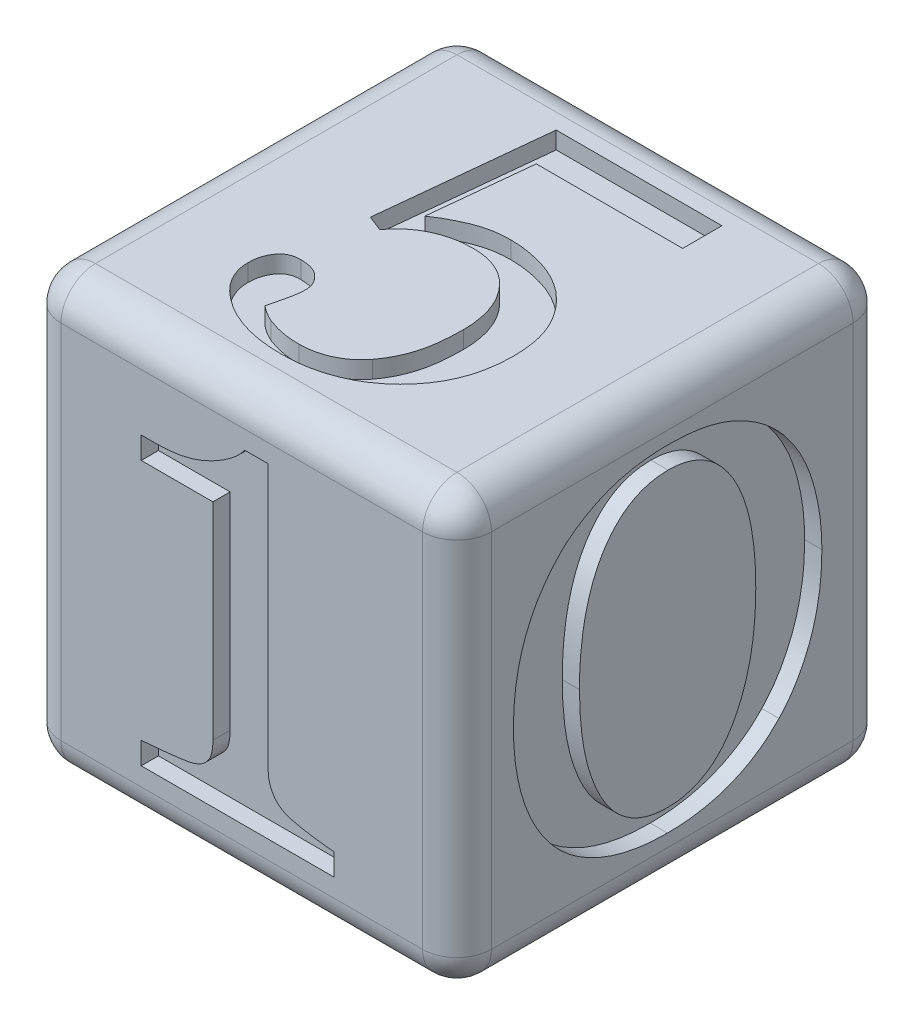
SolidWorks part; units mm, degrees
ref_plane "Front Plane" through (0, 0, 0) normal (0, 0, 1) x (1, 0, 0)
ref_plane "Top Plane" through (0, 0, 0) normal (0, 1, 0) x (1, 0, 0)
ref_plane "Right Plane" through (0, 0, 0) normal (1, 0, 0) x (0, 0, -1)
sketch "Sketch1" plane through (0, 0, 0) normal (0, 1, 0) x (1, 0, 0)
  line L1 (-12.5, 12.5) -> (12.5, 12.5)
  line L2 (-12.5, 12.5) -> (-12.5, -12.5)
  line L3 (-12.5, -12.5) -> (12.5, -12.5)
  line L4 (12.5, 12.5) -> (12.5, -12.5)
  line L5 (-12.5, 12.5) -> (12.5, -12.5) construction
  line L6 (-12.5, -12.5) -> (12.5, 12.5) construction
  point P0 (0, 0)
  dimension "D1" = 25
  dimension "D2" = 25
extrude "Boss-Extrude1" add sketch "Sketch1" along normal blind 25
fillet "Fillet1" radius 2 4 edges at (12.5, 12.5, 12.5) (12.5, 25, 0) (12.5, 12.5, -12.5) (12.5, 0, 0)
fillet "Fillet2" radius 2 5 edges at (11.9142, 24.4142, 11.9142) (11.9142, 0.5858, 11.9142) (-1, 25, 12.5) (-12.5, 12.5, 12.5) (-1, 0, 12.5)
fillet "Fillet3" radius 2 5 edges at (-11.9142, 24.4142, 11.9142) (-11.9142, 0.5858, 11.9142) (-12.5, 25, -1) (-12.5, 12.5, -12.5) (-12.5, 0, -1)
fillet "Fillet4" radius 2 6 edges at (11.9142, 24.4142, -11.9142) (-11.9142, 24.4142, -11.9142) (11.9142, 0.5858, -11.9142) (-11.9142, 0.5858, -11.9142) (0, 25, -12.5) (0, 0, -12.5)
sketch "Sketch9" plane through (0, 0, 0) normal (0, -1, 0) x (1, 0, 0)
  text T0 "3" font "Georgia" height 19
extrude "Cut-Extrude7" cut sketch "Sketch9" against normal blind 1
sketch "Sketch10" plane through (0, 0, -12.5) normal (0, 0, -1) x (-1, 0, 0)
  text T0 "4" font "Georgia" height 19
sketch "Sketch12" plane through (12.5, 0, 0) normal (1, 0, 0) x (0, 0, -1)
  text T0 "0" font "Georgia" height 24
extrude "Cut-Extrude9" cut sketch "Sketch12" against normal blind 1
sketch "Sketch13" plane through (0, 0, 12.5) normal (0, 0, 1) x (1, 0, 0)
  text T0 "1" font "Georgia" height 24
extrude "Cut-Extrude10" cut sketch "Sketch13" against normal blind 1
sketch "Sketch14" plane through (-12.5, 0, 0) normal (-1, 0, 0) x (0, 0, 1)
  text T0 "2" font "Georgia" height 24
extrude "Cut-Extrude11" cut sketch "Sketch14" against normal blind 1
extrude "Cut-Extrude12" cut sketch "Sketch10" against normal blind 1
sketch "Sketch15" plane through (0, 25, 0) normal (0, 1, 0) x (1, 0, 0)
  text T0 "5" font "Georgia" height 19
extrude "Cut-Extrude13" cut sketch "Sketch15" against normal blind 1
